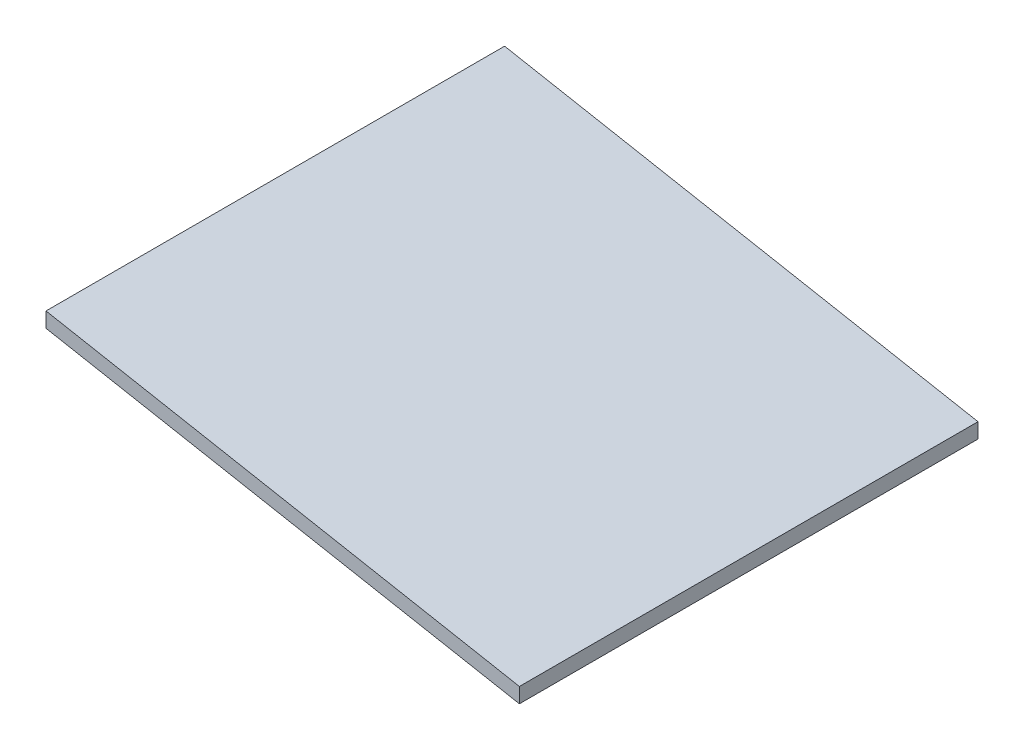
SolidWorks part; units mm, degrees
ref_plane "Front Plane" through (0, 0, 0) normal (0, 0, 1) x (1, 0, 0)
ref_plane "Top Plane" through (0, 0, 0) normal (0, 1, 0) x (1, 0, 0)
ref_plane "Right Plane" through (0, 0, 0) normal (1, 0, 0) x (0, 0, -1)
sketch "Sketch3" plane through (0, 0, -133.1239) normal (0, 0, -1) x (-1, 0, 0)
  line L0 (-203.2, 247.87) -> (203.2, 323.85)
  line L1 (203.2, 323.85) -> (203.2, 310.93)
  line L4 (-203.2, 247.87) -> (-203.2, 234.95)
  line L5 (203.2, 374.65) -> (203.2, -374.65) construction
  line L6 (-203.2, 234.95) -> (203.2, 310.93)
  dimension "D1" = 12.7
  dimension "D2" = 50.8
extrude "Extrude1" add sketch "Sketch3" along normal up to surface (273.2761 mm away) and the other way up to surface (120.4239 mm away)
